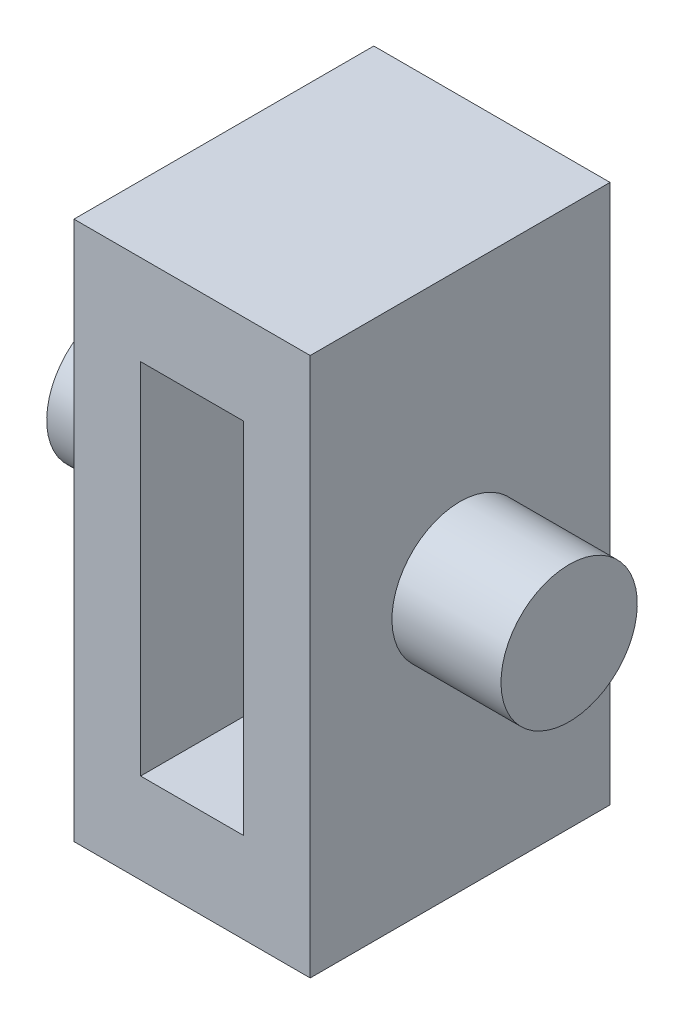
SolidWorks part; units mm, degrees
ref_plane "Front Plane" through (0, 0, 0) normal (0, 0, 1) x (1, 0, 0)
ref_plane "Top Plane" through (0, 0, 0) normal (0, 1, 0) x (1, 0, 0)
ref_plane "Right Plane" through (0, 0, 0) normal (1, 0, 0) x (0, 0, -1)
sketch "Sketch2" plane through (0, 0, 0) normal (0, 0, 1) x (1, 0, 0)
  line L1 (-0.048, 17.7422) -> (7.752, 17.7422)
  line L2 (-0.048, 17.7422) -> (-0.048, -0.0578)
  line L3 (-0.048, -0.0578) -> (7.752, -0.0578)
  line L4 (7.752, 17.7422) -> (7.752, -0.0578)
  dimension "D1" = 17.8
  dimension "D2" = 7.8
extrude "Boss-Extrude1" add sketch "Sketch2" along normal blind 9.9
sketch "Sketch3" plane through (0, 0, 9.9) normal (0, 0, 1) x (1, 0, 0)
  line L0 (7.752, -0.0578) -> (7.752, 17.7422) construction
  line L1 (2.152, 14.7672) -> (5.552, 14.7672)
  line L2 (2.152, 14.7672) -> (2.152, 2.9172)
  line L3 (2.152, 2.9172) -> (5.552, 2.9172)
  line L4 (5.552, 14.7672) -> (5.552, 2.9172)
  line L5 (-0.048, 17.7422) -> (-0.048, -0.0578) construction
  line L6 (-0.048, -0.0578) -> (7.752, -0.0578) construction
  line L7 (7.752, 17.7422) -> (-0.048, 17.7422) construction
  dimension "D1" = 2.2
  dimension "D2" = 2.2
  dimension "D3" = 2.975
  dimension "D4" = 2.975
extrude "Cut-Extrude1" cut sketch "Sketch3" against normal blind 9.9
sketch "Sketch5" plane through (7.752, 0, 0) normal (1, 0, 0) x (0, 0, -1)
  line L0 (-9.9, -0.0578) -> (0, -0.0578) construction
  line L1 (0, -0.0578) -> (0, 17.7422) construction
  circle A0 centre (-4.95, 8.8422) radius 2.25
  dimension "D1" = 4.5
  dimension "D2" = 8.9
  dimension "D3" = 4.95
extrude "Boss-Extrude2" add sketch "Sketch5" along normal blind 3.6
sketch "Sketch6" plane through (-0.048, 0, 0) normal (-1, 0, 0) x (0, 0, 1)
  line L0 (9.9, 17.7422) -> (0, 17.7422) construction
  line L1 (9.9, 17.7422) -> (9.9, -0.0578) construction
  circle A0 centre (4.95, 8.8422) radius 2.25
  dimension "D1" = 4.5
  dimension "D2" = 8.9
  dimension "D3" = 4.95
extrude "Boss-Extrude3" add sketch "Sketch6" along normal blind 3.6
